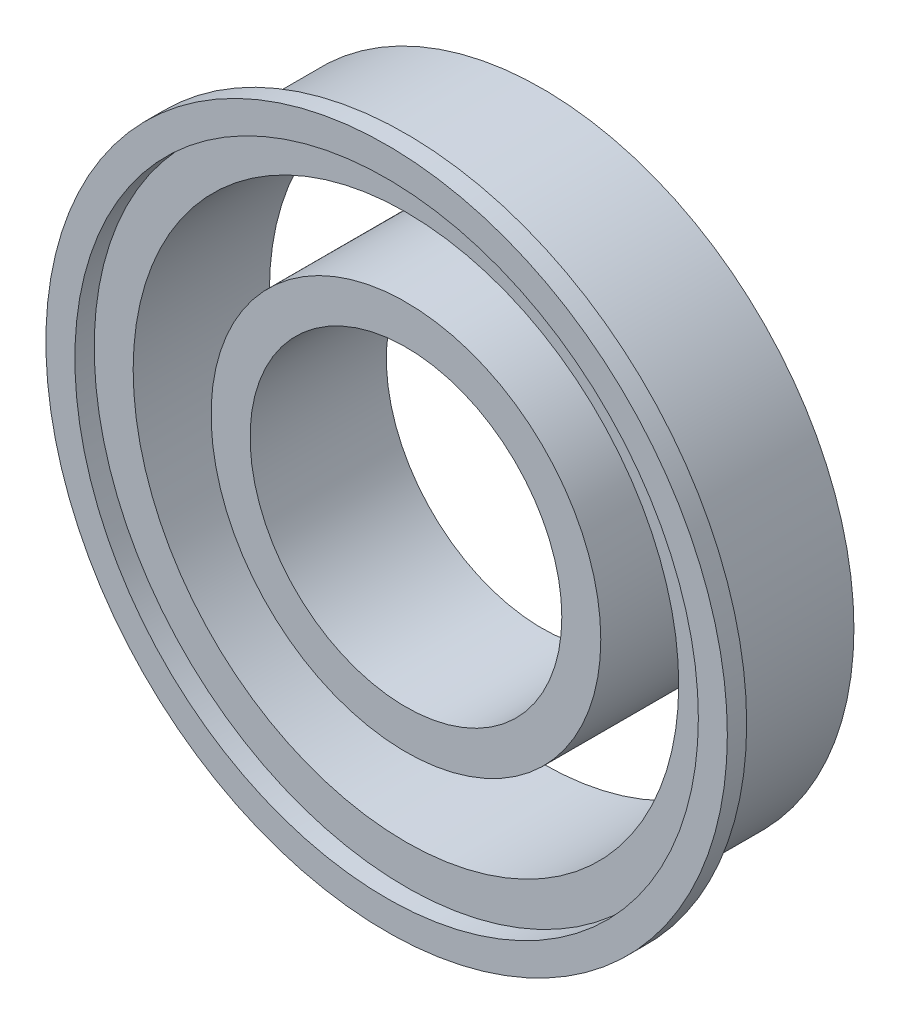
SolidWorks part; units mm, degrees
ref_plane "Front" through (0, 0, 0) normal (0, 0, 1) x (1, 0, 0)
ref_plane "Top" through (0, 0, 0) normal (0, 1, 0) x (1, 0, 0)
ref_plane "Right" through (0, 0, 0) normal (1, 0, 0) x (0, 0, -1)
sketch "Sketch1" plane through (0, 0, 0) normal (0, 0, 1) x (1, 0, 0)
  circle A0 centre (0, 0) radius 15.875
  circle A1 centre (0, 0) radius 12.7
  circle A2 centre (0, 0) radius 22.225
  circle A3 centre (0, 0) radius 25.4
  dimension "D1" = 31.75
  dimension "D2" = 25.4
  dimension "D3" = 50.8
  dimension "D4" = 44.45
extrude "Extrude1" add sketch "Sketch1" along normal mid plane 11.0998 contours A3 A2 | A0 A1
sketch "Sketch4" plane through (0, 0, 5.5499) normal (0, 0, 1) x (1, 0, 0)
  circle A0 centre (0, 0) radius 27.7614
  circle A2 centre (0, 0) radius 25.4
  dimension "D1" = 55.5228
  dimension "D2" = 50.8
extrude "Extrude3" add sketch "Sketch4" along normal blind 1.5748
